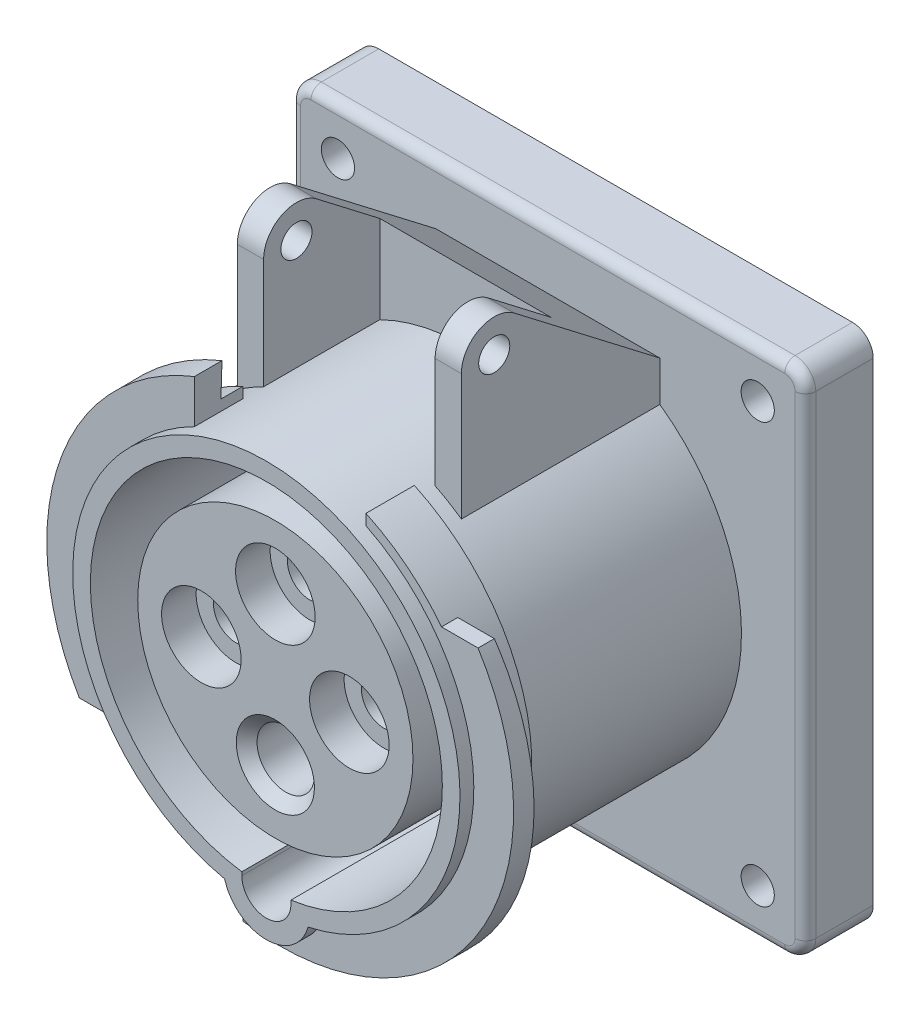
SolidWorks part; units mm, degrees
ref_plane "Спереди" through (0, 0, 0) normal (0, 0, 1) x (1, 0, 0)
ref_plane "Сверху" through (0, 0, 0) normal (0, 1, 0) x (1, 0, 0)
ref_plane "Справа" through (0, 0, 0) normal (1, 0, 0) x (0, 0, -1)
sketch "Эскиз1" plane through (0, 0, 0) normal (0, 0, 1) x (1, 0, 0)
  line L0 (-30.35, 30.35) -> (-30.35, -30.35) construction
  line L1 (-37.25, -37.25) -> (37.25, -37.25)
  line L2 (-37.25, -37.25) -> (-37.25, 37.25)
  line L3 (-37.25, 37.25) -> (37.25, 37.25)
  line L4 (37.25, -37.25) -> (37.25, 37.25)
  line L5 (-37.25, -37.25) -> (37.25, 37.25) construction
  line L6 (-37.25, 37.25) -> (37.25, -37.25) construction
  line L7 (-30.35, -30.35) -> (30.35, -30.35) construction
  line L8 (30.35, -30.35) -> (30.35, 30.35) construction
  line L9 (30.35, 30.35) -> (-30.35, 30.35) construction
  circle A0 centre (-30.35, 30.35) radius 2.4
  circle A1 centre (30.35, 30.35) radius 2.4
  circle A2 centre (30.35, -30.35) radius 2.4
  circle A3 centre (-30.35, -30.35) radius 2.4
  point P0 (0, 0)
  dimension "D3" = 4.8
  dimension "D1" = 74.5
  dimension "D2" = 74.5
  dimension "D4" = 60.7
extrude "Бобышка-Вытянуть1" add sketch "Эскиз1" along normal blind 9.8
sketch "Эскиз2" plane through (0, 0, 9.8) normal (0, 0, 1) x (1, 0, 0)
  circle A0 centre (0, 0) radius 28
  dimension "D1" = 56
extrude "Бобышка-Вытянуть2" add sketch "Эскиз2" along normal blind 40.7
sketch "Эскиз3" plane through (0, 0, 50.5) normal (0, 0, 1) x (1, 0, 0)
  circle A0 centre (0, 0) radius 25.45
  circle A1 centre (0, 0) radius 19.9
  dimension "D1" = 50.9
  dimension "D2" = 39.8
extrude "Вырез-Вытянуть1" cut sketch "Эскиз3" against normal blind 39
sketch "Эскиз4" plane through (0, 0, 50.5) normal (0, 0, 1) x (1, 0, 0)
  circle A0 centre (0, 0) radius 22.65
  dimension "D1" = 45.3
extrude "Вырез-Вытянуть2" cut sketch "Эскиз4" against normal blind 1.3
sketch "Эскиз5" plane through (0, 0, 49.2) normal (0, 0, 1) x (1, 0, 0)
  line L0 (0, 0) -> (0, -10.7) construction
  circle A0 centre (0, -10.7) radius 4.15
  circle A13 centre (0, 10.7) radius 5.75
  circle A14 centre (-10.7, 0) radius 5.75
  circle A15 centre (10.7, 0) radius 5.75
  point P10 (0, 0)
  point P15 (0, 0)
  point P18 (0, 0)
  dimension "D1" = 8.3
  dimension "D4" = 10.7
  dimension "D2" = 11.5
  dimension "D3" = 10.7
  dimension "D5" = 10.7
  dimension "D6" = 10.7
extrude "Вырез-Вытянуть3" cut sketch "Эскиз5" against normal blind 5
sketch "Эскиз6" plane through (0, 0, 44.2) normal (0, 0, 1) x (1, 0, 0)
  circle A0 centre (0, 10.7) radius 3.25
  circle A1 centre (-10.7, 0) radius 3.25
  circle A2 centre (10.7, 0) radius 3.25
  circle A4 centre (0, -10.7) radius 4.15
  dimension "D1" = 6.5
  dimension "D2" = 8.3
extrude "Вырез-Вытянуть4" cut sketch "Эскиз6" against normal blind 20
chamfer "Фаска1" distance 1.5 angle 45 1 edges at (4.15, -10.7, 49.2)
sketch "Эскиз7" plane through (0, 0, 9.8) normal (0, 0, 1) x (1, 0, 0)
  arc A0 (-6.0271, -27.3436) -> (6.0271, -27.3436) centre (0, -25.6893) ccw
  circle A4 centre (0, 0) radius 28 construction
  arc A5 (-6.0271, -27.3436) -> (6.0271, -27.3436) centre (0, 0) ccw
  point P1 (0, 0)
  point P2 (0, 0)
  point P4 (0, -31.9393)
  dimension "D1" = 12.5
extrude "Бобышка-Вытянуть3" add sketch "Эскиз7" along normal up to surface (40.7 mm away)
sketch "Эскиз8" plane through (0, 0, 50.5) normal (0, 0, 1) x (1, 0, 0)
  line L0 (-3.55, -25.6893) -> (-3.55, -25.2012)
  line L1 (3.55, -25.6893) -> (3.55, -25.2012)
  circle A1 centre (0, 0) radius 25.45 construction
  arc A2 (-3.4234, -26.629) -> (3.4234, -26.629) centre (0, -25.6893) ccw
  arc A3 (-3.55, -25.6893) -> (3.55, -25.6893) centre (0, -25.6893) ccw
  arc A4 (-3.55, -25.2012) -> (3.55, -25.2012) centre (0, 0) ccw
  dimension "D1" = 2.7
extrude "Вырез-Вытянуть5" cut sketch "Эскиз8" against normal up to surface (39 mm away)
ref_plane "Плоскость1" through (0, 0, 48.5) normal (0, 0, 1) x (1, 0, 0)
sketch "Эскиз9" plane through (0, 0, 48.5) normal (0, 0, 1) x (1, 0, 0)
  circle A0 centre (0, 0) radius 33.75
  arc A1 (-6.0271, -27.3436) -> (6.0271, -27.3436) centre (0, -25.6893) ccw construction
  arc A2 (6.0271, -27.3436) -> (-6.0271, -27.3436) centre (0, 0) ccw construction
  arc A3 (-6.0271, -27.3436) -> (6.0271, -27.3436) centre (0, -25.6893) ccw
  arc A4 (6.0271, -27.3436) -> (-6.0271, -27.3436) centre (0, 0) ccw
  dimension "D1" = 67.5
extrude "Бобышка-Вытянуть4" add sketch "Эскиз9" against normal blind 4.3
sketch "Эскиз10" plane through (0, 0, 44.2) normal (0, 0, -1) x (-1, 0, 0)
  line L0 (-3.55, -25.6893) -> (-3.55, -25.2012) construction
  line L1 (3.55, -25.2012) -> (3.55, -25.6893) construction
  line L2 (-3.55, -25.6893) -> (-3.55, -25.2012)
  line L3 (3.55, -25.2012) -> (3.55, -25.6893)
  circle A0 centre (0, 0) radius 29.4
  arc A1 (3.55, -25.2012) -> (-3.55, -25.2012) centre (0, 0) ccw
  arc A2 (-3.55, -25.6893) -> (3.55, -25.6893) centre (0, -25.6893) ccw construction
  arc A3 (-3.55, -25.6893) -> (3.55, -25.6893) centre (0, -25.6893) ccw
  dimension "D1" = 58.8
extrude "Бобышка-Вытянуть5" add sketch "Эскиз10" along normal blind 2.7
ref_plane "Плоскость2" through (0, 0, 38.5) normal (0, 0, 1) x (1, 0, 0)
sketch "Эскиз11" plane through (0, 0, 38.5) normal (0, 0, 1) x (1, 0, 0)
  line L0 (-16.2, 22.8377) -> (-16.2, 45.8)
  line L1 (-16.2, 45.8) -> (16.2, 45.8)
  line L2 (16.2, 45.8) -> (16.2, 22.8377)
  arc A0 (6.0271, -27.3436) -> (-6.0271, -27.3436) centre (0, 0) ccw construction
  arc A1 (16.2, 22.8377) -> (-16.2, 22.8377) centre (0, 0) ccw
  point P6 (0, 45.8)
  point P8 (0, 28)
  dimension "D1" = 32.4
  dimension "D2" = 17.8
extrude "Бобышка-Вытянуть6" add sketch "Эскиз11" against normal up to surface (28.7 mm away)
sketch "Эскиз12" plane through (16.2, 0, 0) normal (1, 0, 0) x (0, 0, -1)
  line L0 (-9.8, 28.65) -> (-30.8573, 44.8176)
  line L1 (-9.8, -37.25) -> (-9.8, 37.25) construction
  line L2 (-9.8, 45.8) -> (-38.5, 45.8) construction
  line L3 (-9.8, 37.25) -> (0, 37.25) construction
  line L4 (-38.5, 22.8377) -> (-38.5, 45.8) construction
  line L6 (-9.8, 37.25) -> (-9.8, 45.8) construction
  line L7 (-38.5, 41.05) -> (-38.5, 46.8)
  line L9 (-9.8, 28.65) -> (-9.8, 46.8)
  line L10 (-9.8, 46.8) -> (-38.5, 46.8)
  arc A0 (-30.8573, 44.8176) -> (-38.5, 41.05) centre (-33.75, 41.05) ccw
  point P10 (-33.1946, 39.0252)
  dimension "D2" = 9.5
  dimension "D1" = 8.6
  dimension "D3" = 1
extrude "Вырез-Вытянуть6" cut sketch "Эскиз12" against normal up to next
ref_plane "Плоскость3" through (0, 45.8, 0) normal (0, 1, 0) x (1, 0, 0)
sketch "Эскиз13" plane through (0, 45.8, 0) normal (0, 1, 0) x (1, 0, 0)
  line L0 (-30.8, -38.5) -> (30.8, -38.5) construction
  line L1 (-12.4, -38.5) -> (12.4, -38.5)
  line L2 (-12.4, -38.5) -> (-12.4, -21.7)
  line L3 (-12.4, -21.7) -> (12.4, -21.7)
  line L4 (12.4, -38.5) -> (12.4, -21.7)
  point P6 (0, -21.7)
  dimension "D1" = 24.8
  dimension "D2" = 16.8
extrude "Вырез-Вытянуть7" cut sketch "Эскиз13" against normal up to surface (20.6954 mm away)
sketch "Эскиз14" plane through (16.2, 0, 0) normal (1, 0, 0) x (0, 0, -1)
  circle A0 centre (-33.75, 41.05) radius 2.25
  dimension "D1" = 4.5
extrude "Вырез-Вытянуть8" cut sketch "Эскиз14" against normal up to surface (32.4 mm away)
sketch "Эскиз16" plane through (0, 0, 41.5) normal (0, 0, -1) x (-1, 0, 0)
  line L0 (12.4, 25.1046) -> (12.4, 41.05) construction
  line L1 (-12.4, 25.1046) -> (-12.4, 41.05) construction
  line L2 (12.4, 25.1046) -> (12.4, 31.3895)
  line L3 (-12.4, 25.1046) -> (-12.4, 31.3895)
  circle A0 centre (0, 0) radius 33.75 construction
  arc A1 (6.0271, -27.3436) -> (-6.0271, -27.3436) centre (0, 0) ccw construction
  arc A2 (12.4, 31.3895) -> (-12.4, 31.3895) centre (0, 0) ccw
  arc A3 (12.4, 25.1046) -> (-12.4, 25.1046) centre (0, 0) ccw
extrude "Вырез-Вытянуть9" cut sketch "Эскиз16" against normal up to next
sketch "Эскиз18" plane through (0, 0, 44.2) normal (0, 0, -1) x (-1, 0, 0)
  line L0 (-23.3229, 17.8998) -> (-28.6122, 17.8998)
  line L1 (-12.4, 31.3895) -> (-12.4, 26.6571)
  line L2 (5.3577, -28.9077) -> (5.3577, -33.322)
  line L3 (29.0478, -17.1839) -> (23.8553, -17.1839)
  arc A0 (-12.4, 26.6571) -> (-5.3577, -28.9077) centre (0, 0) ccw construction
  arc A1 (-12.4, 26.6571) -> (-23.3229, 17.8998) centre (0, 0) ccw
  arc A2 (-12.4, 31.3895) -> (12.4, 31.3895) centre (0, 0) ccw construction
  arc A4 (5.3577, -28.9077) -> (12.4, 26.6571) centre (0, 0) ccw construction
  arc A5 (5.3577, -28.9077) -> (23.8553, -17.1839) centre (0, 0) ccw
  arc A6 (-12.4, 31.3895) -> (-28.6122, 17.8998) centre (0, 0) ccw
  arc A7 (5.3577, -33.322) -> (29.0478, -17.1839) centre (0, 0) ccw
  dimension "D1" = 14
  dimension "D2" = 21.9
extrude "Вырез-Вытянуть10" cut sketch "Эскиз18" against normal up to next
ref_plane "Плоскость4" through (0, -33.75, 0) normal (0, -1, 0) x (-1, 0, 0)
sketch "Эскиз19" plane through (0, -33.75, 0) normal (0, -1, 0) x (-1, 0, 0)
  line L0 (5.3577, -44.2) -> (5.3577, -46.5)
  line L1 (5.3577, -48.5) -> (5.3577, -44.2) construction
  line L2 (5.3577, -46.5) -> (0, -46.5)
  line L3 (0, -46.5) -> (0, -44.2)
  line L4 (5.3577, -44.2) -> (-33.75, -44.2) construction
  line L5 (0, -44.2) -> (5.3577, -44.2)
  line L6 (-6.0271, -50.5) -> (6.0271, -50.5) construction
  line L7 (-33.75, -48.5) -> (5.3577, -48.5) construction
  point P11 (0, -50.5)
  dimension "D1" = 2
extrude "Вырез-Вытянуть11" cut sketch "Эскиз19" against normal up to surface (1.8107 mm away)
sketch "Эскиз20" plane through (0, 0, 44.2) normal (0, 0, -1) x (-1, 0, 0)
  line L0 (0, -33.75) -> (0, -31.9393)
  line L1 (-2, -33.6907) -> (-2, -31.6107)
  arc A0 (-5.3577, -28.9077) -> (0, -31.9393) centre (0, -25.6893) ccw construction
  arc A1 (-28.6122, 17.8998) -> (0, -33.75) centre (0, 0) ccw construction
  arc A2 (-2, -31.6107) -> (0, -31.9393) centre (0, -25.6893) ccw
  arc A3 (-2, -33.6907) -> (0, -33.75) centre (0, 0) ccw
  dimension "D1" = 2
extrude "Бобышка-Вытянуть7" add sketch "Эскиз20" along normal up to surface (2.7 mm away)
ref_plane "Плоскость5" through (0, -0.3657, 11.0236) normal (0, -0.0332, 0.9995) x (1, 0, 0)
ref_plane "Плоскость6" through (0, -1.5095, 45.5046) normal (0, -0.0332, 0.9995) x (1, 0, 0)
sketch "Эскиз22" plane through (0, 0, 44.2) normal (0, 0, -1) x (-1, 0, 0)
  line L2 (-2, -33.6907) -> (-2, -31.6107)
  line L3 (-23.3229, 17.8998) -> (-28.6122, 17.8998)
  line L4 (-2, -33.6907) -> (-2, -31.6107)
  line L5 (-23.3229, 17.8998) -> (-28.6122, 17.8998)
  arc A3 (-5.3577, -28.9077) -> (-2, -31.6107) centre (0, -25.6893) ccw
  arc A4 (-23.3229, 17.8998) -> (-5.3577, -28.9077) centre (0, 0) ccw
  arc A5 (-28.6122, 17.8998) -> (-2, -33.6907) centre (0, 0) ccw
  arc A6 (-5.3577, -28.9077) -> (-2, -31.6107) centre (0, -25.6893) ccw
  arc A7 (-23.3229, 17.8998) -> (-5.3577, -28.9077) centre (0, 0) ccw
  arc A8 (-28.6122, 17.8998) -> (-2, -33.6907) centre (0, 0) ccw
  dimension "D1" = 0
extrude "Вырез-Вытянуть13" cut sketch "Эскиз22" against normal up to surface (1.9485 mm away)
ref_plane "Плоскость7" through (0, 0.3657, 11.0236) normal (0, 0.0332, 0.9995) x (-1, 0, 0)
ref_plane "Плоскость8" through (0, 1.5095, 45.5046) normal (0, 0.0332, 0.9995) x (-1, 0, 0)
sketch "Эскиз23" plane through (0, 0, 44.2) normal (0, 0, -1) x (-1, 0, 0)
  line L2 (23.8553, -17.1839) -> (29.0478, -17.1839)
  line L3 (12.4, 31.3895) -> (12.4, 26.6571)
  line L4 (23.8553, -17.1839) -> (29.0478, -17.1839)
  line L5 (12.4, 31.3895) -> (12.4, 26.6571)
  arc A2 (23.8553, -17.1839) -> (12.4, 26.6571) centre (0, 0) ccw
  arc A3 (29.0478, -17.1839) -> (12.4, 31.3895) centre (0, 0) ccw
  arc A4 (23.8553, -17.1839) -> (12.4, 26.6571) centre (0, 0) ccw
  arc A5 (29.0478, -17.1839) -> (12.4, 31.3895) centre (0, 0) ccw
  dimension "D1" = 0
extrude "Вырез-Вытянуть14" cut sketch "Эскиз23" against normal up to surface (1.9247 mm away)
fillet "Скругление1" radius 3 4 edges at (-37.25, 37.25, 4.9) (-37.25, -37.25, 4.9) (37.25, -37.25, 4.9) (37.25, 37.25, 4.9)
fillet "Скругление2" radius 1.5 8 edges at (-36.3713, 36.3713, 9.8) (0, 37.25, 9.8) (36.3713, 36.3713, 9.8) (37.25, 0, 9.8) (36.3713, -36.3713, 9.8) (0, -37.25, 9.8) (-36.3713, -36.3713, 9.8) (-37.25, 0, 9.8)
sketch "Эскиз24" plane through (0, 0, 0) normal (0, 0, -1) x (-1, 0, 0)
  circle A0 centre (0, 0) radius 22.75
  dimension "D1" = 45.5
extrude "Вырез-Вытянуть15" cut sketch "Эскиз24" against normal blind 8.5
sketch "Эскиз25" plane through (0, 0, 8.5) normal (0, 0, -1) x (-1, 0, 0)
  circle A0 centre (0, 0) radius 20.45
  dimension "D1" = 40.9
extrude "Бобышка-Вытянуть8" add sketch "Эскиз25" along normal blind 17.5
sketch "Эскиз26" plane through (0, 0, -9) normal (0, 0, -1) x (-1, 0, 0)
  line L0 (-9.8192, 6.7583) -> (-8.1886, 0.6729)
  line L1 (-14.842, 5.4124) -> (-13.2114, -0.6729)
  line L2 (-9.8192, 6.7583) -> (-14.842, 5.4124)
  line L3 (0, 0) -> (0, 10.7) construction
  line L4 (6.558, 5.4124) -> (8.1886, -0.6729)
  line L5 (11.5808, 6.7583) -> (6.558, 5.4124)
  line L6 (11.5808, 6.7583) -> (13.2114, 0.6729)
  circle A0 centre (0, 10.7) radius 2.6
  arc A1 (-13.2114, -0.6729) -> (-8.1886, 0.6729) centre (-10.7, 0) ccw
  arc A2 (8.1886, -0.6729) -> (13.2114, 0.6729) centre (10.7, 0) ccw
  dimension "D1" = 5.2
  dimension "D2" = 5.2
  dimension "D3" = 15
  dimension "D4" = 6.3
  dimension "D5" = 5.2
  dimension "D6" = 6.3
  dimension "D7" = 6.3
  dimension "D8" = 15
extrude "Вырез-Вытянуть16" cut sketch "Эскиз26" against normal blind 3
sketch "Эскиз27" plane through (0, 0, -6) normal (0, 0, -1) x (-1, 0, 0)
  circle A0 centre (-10.7, 0) radius 2.5
  circle A1 centre (0, 10.7) radius 2.5
  circle A2 centre (10.7, 0) radius 2.5
  dimension "D1" = 5
extrude "Вырез-Вытянуть17" cut sketch "Эскиз27" against normal blind 5
sketch "Эскиз28" plane through (0, 0, -9) normal (0, 0, -1) x (-1, 0, 0)
  line L0 (-11.7764, -3.0894) -> (-4.6858, -4.3397)
  line L1 (-13.6692, -13.8238) -> (-6.5785, -15.0741)
  line L2 (-4.6858, -4.3397) -> (-6.5785, -15.0741) construction
  line L3 (0, 0) -> (0, 10.7) construction
  line L4 (-11.7764, -3.0894) -> (-13.6692, -13.8238)
  arc A0 (-6.5785, -15.0741) -> (-4.6858, -4.3397) centre (0, -10.7) ccw
  circle A1 centre (0, -10.7) radius 2.85
  dimension "D1" = 15.8
  dimension "D5" = 5.7
  dimension "D2" = 10.9
  dimension "D3" = 7.2
  dimension "D4" = 10
extrude "Бобышка-Вытянуть9" add sketch "Эскиз28" along normal blind 6.7
sketch "Эскиз29" plane through (0, 0, -15.7) normal (0, 0, -1) x (-1, 0, 0)
  line L0 (-7.9252, -6.2765) -> (-7.6252, -6.2765)
  line L1 (-7.9252, -6.2765) -> (-7.9252, -9.2765)
  line L2 (-7.6252, -6.2765) -> (-7.6252, -9.2765)
  line L3 (-7.6252, -9.2765) -> (-4.5752, -9.2765)
  line L4 (-10.9752, -9.2765) -> (-7.9252, -9.2765)
  line L5 (-10.9752, -9.2765) -> (-10.9752, -9.5765)
  line L6 (-10.9752, -9.5765) -> (-4.5752, -9.5765)
  line L7 (-4.5752, -9.2765) -> (-4.5752, -9.5765)
  line L8 (-9.7252, -10.3765) -> (-5.8252, -10.3765)
  line L9 (-9.7252, -10.3765) -> (-9.7252, -10.6765)
  line L10 (-9.7252, -10.6765) -> (-5.8252, -10.6765)
  line L11 (-5.8252, -10.3765) -> (-5.8252, -10.6765)
  line L12 (-8.8252, -11.4765) -> (-6.7252, -11.4765)
  line L13 (-8.8252, -11.4765) -> (-8.8252, -11.7765)
  line L14 (-8.8252, -11.7765) -> (-6.7252, -11.7765)
  line L15 (-6.7252, -11.4765) -> (-6.7252, -11.7765)
  point P4 (-7.7752, -6.2765)
  point P13 (-7.7752, -10.3765)
  point P14 (-7.7752, -9.5765)
  point P15 (-7.7752, -11.4765)
  point P16 (-7.7752, -10.6765)
  dimension "D1" = 0.3
  dimension "D2" = 3
  dimension "D3" = 6.4
  dimension "D4" = 0.3
  dimension "D5" = 0.3
  dimension "D6" = 0.8
  dimension "D7" = 3.9
  dimension "D8" = 2.1
  dimension "D9" = 0.3
  dimension "D10" = 0.8
extrude "Бобышка-Вытянуть10" add sketch "Эскиз29" along normal blind 0.1
sketch "Эскиз30" plane through (0, 0, -9) normal (0, 0, -1) x (-1, 0, 0)
  text T0 "L1" font "Arial" height 2.5
  text T1 "L2" font "Arial" height 2.5
  text T2 "L3" font "Arial" height 2.5
extrude "Бобышка-Вытянуть11" add sketch "Эскиз30" along normal blind 0.1
